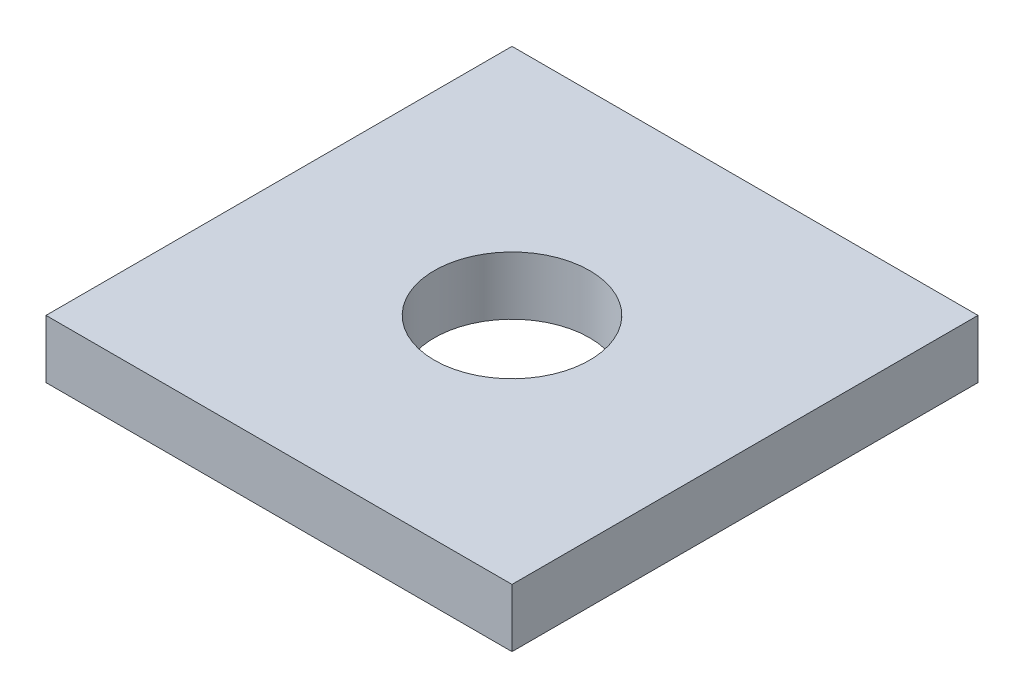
SolidWorks part; units mm, degrees
ref_plane "Front" through (0, 0, 0) normal (0, 0, 1) x (1, 0, 0)
ref_plane "Top" through (0, 0, 0) normal (0, 1, 0) x (1, 0, 0)
ref_plane "Right" through (0, 0, 0) normal (1, 0, 0) x (0, 0, -1)
sketch "Sketch1" plane through (0, 0, 0) normal (0, 1, 0) x (1, 0, 0)
  line L1 (0, 0) -> (12, 0)
  line L2 (0, 0) -> (0, 12)
  line L3 (0, 12) -> (12, 12)
  line L4 (12, 0) -> (12, 12)
  circle A0 centre (6, 6) radius 2
extrude "Boss-Extrude2" add sketch "Sketch1" along normal blind 1.5
equation "\"D2@Sketch1\"= \"D1@Sketch1\" / 2"
equation "\"D3@Sketch1\"=\"D1@Sketch1\" / 2"
